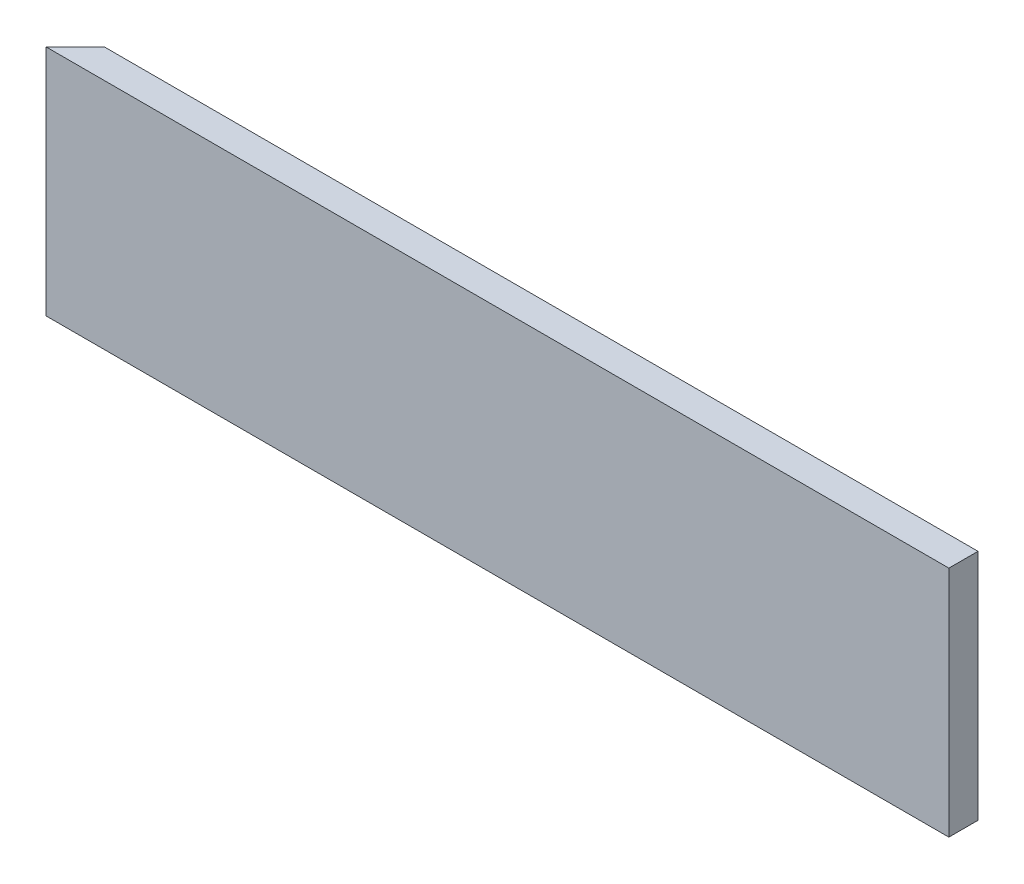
SolidWorks part; units mm, degrees
ref_plane "Front Plane" through (0, 0, 0) normal (0, 0, 1) x (1, 0, 0)
ref_plane "Top Plane" through (0, 0, 0) normal (0, 1, 0) x (1, 0, 0)
ref_plane "Right Plane" through (0, 0, 0) normal (1, 0, 0) x (0, 0, -1)
sketch "Sketch2" plane through (0, 0, 0) normal (0, 1, 0) x (1, 0, 0)
  line L0 (0, 0) -> (0, -25.4)
  line L1 (0, -25.4) -> (-787.4, -25.4)
  line L2 (-787.4, -25.4) -> (-762, 0)
  line L3 (-762, 0) -> (0, 0)
extrude "Boss-Extrude1" add sketch "Sketch2" along normal blind 203.2
equation "\"system_width\"= 7ft + 10 "
equation "\"system_length\"= 95.5"
equation "\"module_board_length\"= 11.25in"
equation "\"module_board_width\"= 1.5in"
equation "\"module_width\"= (\"system_width\" -  2* \"module_trim_thickness\") / 2"
equation "\"module_board_short_depth\"= \"module_width\" - ( 2 * \"module_board_width\" ) - \"module_lip_width\""
equation "\"module_board_hole\"= 0.5in"
equation "\"module_board_hole_seperation\"= 20in"
equation "\"system_step_width\"= 3ft"
equation "\"system_top_length\"= \"system_length\" - \"system_step_length\""
equation "\"module_top_thickness\"= 0.75in"
equation "\"module_lip_width\"= 1.5in"
equation "\"module_trim_thickness\"= 1in"
equation "\"module_trim_height\"= 14in"
equation "\"module_top_overhang\"= 4.5in"
equation "\"module_trim_angle\"= 45deg"
equation "\"module_length\"= (\"system_top_length\" - \"module_trim_thickness\")/ 2"
equation "\"module_board_long_depth\"= \"module_length\" - \"module_lip_width\""
equation "\"module_board_hole_position\"= ( ( \"module_width\" - \"module_board_hole_seperation\" ) / 2 ) + \"module_board_width\"/2"
equation "\"D1@Sketch2\"=\"step_module_length\" + \"module_trim_thickness\"-\"module_top_overhang\""
equation "\"step_board_length\"= 5.5in"
equation "\"step_board_width\"= 1.5in"
equation "\"system_step_length\"= 2ft+11.5"
equation "\"step_module_width\"= \"module_width\""
equation "\"step_module_length\"= \"system_step_length\" - \"module_trim_thickness\""
equation "\"step_board_short_depth\"= \"step_module_length\" - \"module_lip_width\""
equation "\"step_board_long_depth\"= \"step_module_width\" - (2 * \"module_board_width\") - \"module_lip_width\""
equation "\"step_trim_height\"= 8in"
equation "\"D2@Sketch2\"=\"module_trim_thickness\""
